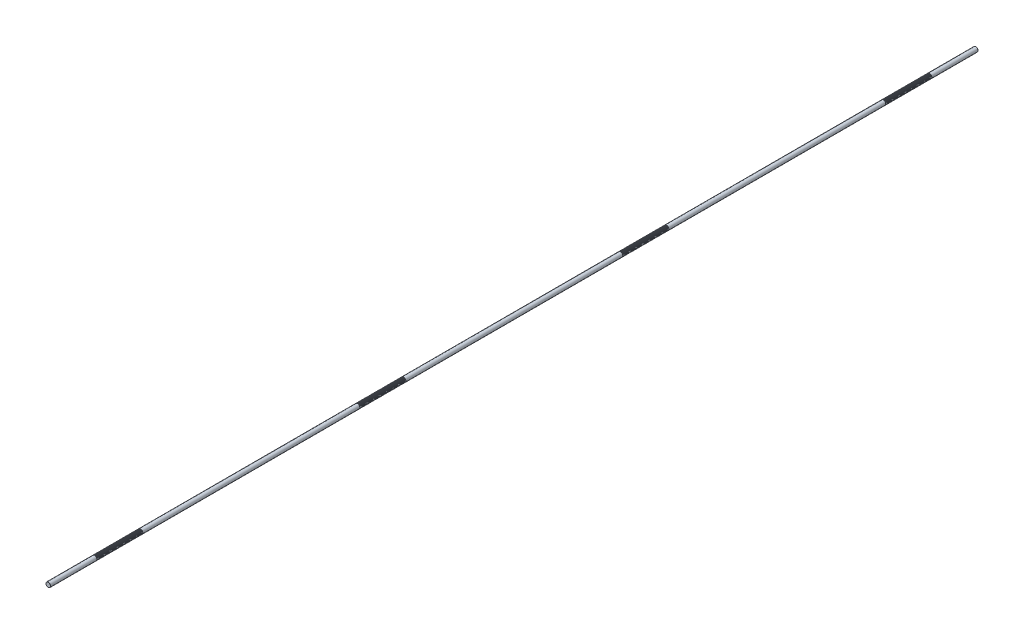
SolidWorks part; units mm, degrees
ref_plane "Front Plane" through (0, 0, 0) normal (0, 0, 1) x (1, 0, 0)
ref_plane "Top Plane" through (0, 0, 0) normal (0, 1, 0) x (1, 0, 0)
ref_plane "Right Plane" through (0, 0, 0) normal (1, 0, 0) x (0, 0, -1)
sketch "Sketch1" plane through (0, 0, 0) normal (0, 0, 1) x (1, 0, 0)
  circle A0 centre (0, 0) radius 5
  dimension "D1" = 10
extrude "Boss-Extrude1" add sketch "Sketch1" along normal mid plane 2000
chamfer "Chamfer1" distance 0.25 angle 45 2 edges at (5, 0, -1000) (5, 0, 1000)
sketch "Sketch2" plane through (0, 0, 0) normal (1, 0, 0) x (0, 0, -1)
  line L0 (900.1675, 5) -> (898.8325, 5)
  line L1 (999.75, 5) -> (-999.75, 5) construction
  line L2 (898.8325, 5) -> (899.1675, 3.75)
  line L3 (899.1675, 3.75) -> (899.8325, 3.75)
  line L4 (899.8325, 3.75) -> (900.1675, 5)
  line L5 (1000, -4.75) -> (1000, 4.75) construction
  point P4 (899.5, 5)
  point P7 (899.5, 3.75)
  point P8 (900, 4.375)
  point P9 (899, 4.375)
  dimension "D1" = 1
  dimension "D2" = 100
  dimension "D3" = 1.25
  dimension "D4" = 30
revolve "Cut-Revolve1" cut sketch "Sketch2" angle 360 about axis through (0, 0, 1000) along (0, 0, -1)
pattern_linear "LPattern1" count 50 spacing 2 along (0, 0, 1) of "Cut-Revolve1"
pattern_linear "LPattern2" count 4 spacing 567 along (0, 0, 1) of "Cut-Revolve1", "LPattern1"
